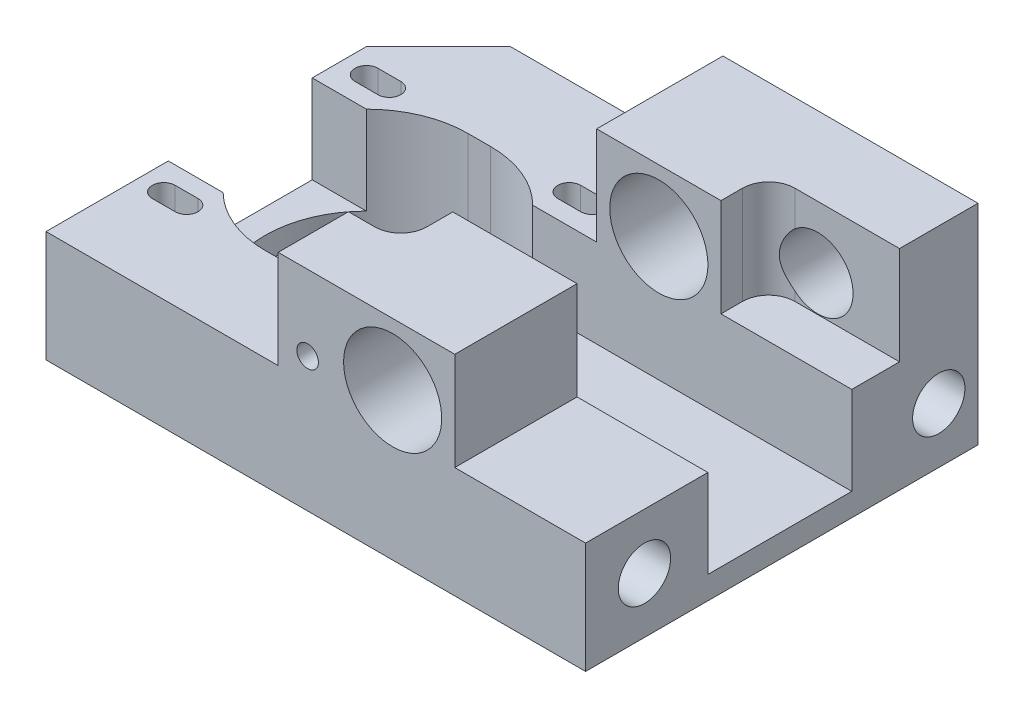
SolidWorks part; units mm, degrees
ref_plane "Plan de face" through (0, 0, 0) normal (0, 0, 1) x (1, 0, 0)
ref_plane "Plan de dessus" through (0, 0, 0) normal (0, 1, 0) x (1, 0, 0)
ref_plane "Plan de droite" through (0, 0, 0) normal (1, 0, 0) x (0, 0, -1)
sketch "Esquisse1" plane through (0, 0, 0) normal (0, 1, 0) x (1, 0, 0)
  line L0 (0, 0) -> (0, 49)
  line L1 (0, 49) -> (11, 60)
  line L2 (11, 60) -> (82.5, 60)
  line L3 (82.5, 60) -> (82.5, 0)
  line L4 (82.5, 0) -> (0, 0)
  line L5 (34.75, 47) -> (38.25, 47)
  line L6 (3.75, 47) -> (7.25, 47)
  line L7 (34.75, 43.5) -> (38.25, 43.5)
  line L8 (3.75, 43.5) -> (7.25, 43.5)
  line L9 (34.75, 16) -> (38.25, 16)
  line L10 (34.75, 12.5) -> (38.25, 12.5)
  line L11 (3.75, 16) -> (7.25, 16)
  line L12 (3.75, 12.5) -> (7.25, 12.5)
  line L13 (19.25, 29.75) -> (22.75, 29.75) construction
  line L14 (19.25, 45.25) -> (22.75, 45.25)
  line L15 (19.25, 14.25) -> (22.75, 14.25)
  arc A0 (7.25, 47) -> (7.25, 43.5) centre (7.25, 45.25) cw
  arc A1 (3.75, 47) -> (3.75, 43.5) centre (3.75, 45.25) ccw
  arc A2 (34.75, 47) -> (34.75, 43.5) centre (34.75, 45.25) ccw
  arc A3 (38.25, 47) -> (38.25, 43.5) centre (38.25, 45.25) cw
  arc A4 (34.75, 16) -> (34.75, 12.5) centre (34.75, 14.25) ccw
  arc A5 (38.25, 16) -> (38.25, 12.5) centre (38.25, 14.25) cw
  arc A6 (3.75, 16) -> (3.75, 12.5) centre (3.75, 14.25) ccw
  arc A7 (7.25, 16) -> (7.25, 12.5) centre (7.25, 14.25) cw
  arc A8 (19.25, 45.25) -> (19.25, 14.25) centre (19.25, 29.75) ccw
  arc A9 (22.75, 14.25) -> (22.75, 45.25) centre (22.75, 29.75) ccw
  point P32 (21, 29.75)
  dimension "D7" = 1.75
  dimension "D11" = 15.5
  dimension "D1" = 82.5
  dimension "D2" = 60
  dimension "D3" = 11
  dimension "D4" = 11
  dimension "D5" = 16.5
  dimension "D6" = 3.75
  dimension "D10" = 3.5
  dimension "D12" = 21
  dimension "D13" = 3.5
  dimension "D14" = 30.25
  dimension "D15" = 31
  dimension "D16" = 31
  dimension "D8" = 2
  dimension "D9" = 2
extrude "Boss.-Extru.1" add sketch "Esquisse1" along normal blind 32
sketch "Esquisse2" plane through (0, 32, 0) normal (0, 1, 0) x (1, 0, 0)
  line L0 (0, 49) -> (11, 60)
  line L1 (11, 60) -> (43.5, 60)
  line L2 (82.5, 60) -> (11, 60) construction
  line L3 (43.5, 60) -> (43.5, 14.75)
  line L4 (39.5, 10.75) -> (35.5, 10.75)
  line L5 (35.5, 10.75) -> (35.5, 0)
  line L6 (0, 0) -> (82.5, 0) construction
  line L7 (35.5, 0) -> (0, 0)
  line L8 (0, 0) -> (0, 49)
  line L9 (66.5, 48) -> (82.5, 48)
  line L10 (82.5, 0) -> (82.5, 60) construction
  line L11 (82.5, 48) -> (82.5, 0)
  line L12 (82.5, 0) -> (62.5, 0)
  line L13 (62.5, 0) -> (62.5, 44)
  arc A0 (43.5, 14.75) -> (39.5, 10.75) centre (39.5, 14.75) cw
  arc A1 (66.5, 48) -> (62.5, 44) centre (66.5, 44) ccw
  dimension "D6" = 4
  dimension "D1" = 10.75
  dimension "D2" = 19
  dimension "D3" = 12
  dimension "D4" = 20
  dimension "D5" = 27
extrude "Enlèv. mat.-Extru.1" cut sketch "Esquisse2" against normal blind 15
sketch "Esquisse3" plane through (0, 0, -60) normal (0, 0, -1) x (-1, 0, 0)
  line L0 (-82.5, 0) -> (-11, 0) construction
  line L1 (-82.5, 32) -> (-82.5, 0) construction
  circle A0 centre (-53, 22.5) radius 7.5
  dimension "D3" = 15
  dimension "D1" = 22.5
  dimension "D2" = 29.5
extrude "Enlèv. mat.-Extru.2" cut sketch "Esquisse3" against normal through all
hole_wizard "Trou taraudé M12x1.251" positions "Esquisse5" profile "Esquisse4" tap size "M12x1.25" standard "ISO"
sketch "Esquisse5" plane through (0, 0, -60) normal (0, 0, -1) x (-1, 0, 0)
  line L0 (-82.5, 0) -> (-11, 0) construction
  line L1 (-82.5, 32) -> (-82.5, 0) construction
  point P0 (-70, 22.5)
  dimension "D1" = 22.5
  dimension "D2" = 12.5
sketch "Esquisse4" plane through (70, 22.5, -60) normal (1, 0, 0) x (0, 1, 0)
  line L0 (0, 0) -> (0, 60)
  line L1 (0, 60) -> (5.4, 60)
  line L2 (5.4, 60) -> (5.4, 0)
  line L5 (5.4, 0) -> (0, 0)
  line L11 (0, -6.35) -> (0, 107.95) construction
  dimension "Diamètre du trou pour taraudage jusqu'au prochain" = 10.8
  dimension "Profondeur du trou pour taraudage jusqu'au prochain" = 60
hole_wizard "Trou taraudé M41" positions "Esquisse7" profile "Esquisse6" tap size "M4" standard "ISO"
sketch "Esquisse7" plane through (0, 0, 0) normal (0, 0, 1) x (1, 0, 0)
  line L0 (82.5, 17) -> (82.5, 0) construction
  line L1 (0, 0) -> (82.5, 0) construction
  point P0 (40, 20.5)
  dimension "D1" = 42.5
  dimension "D2" = 20.5
sketch "Esquisse6" plane through (40, 20.5, 0) normal (1, 0, 0) x (0, -1, 0)
  line L0 (0, 0) -> (0, 60)
  line L1 (0, 60) -> (1.65, 60)
  line L2 (1.65, 60) -> (1.65, 0)
  line L5 (1.65, 0) -> (0, 0)
  line L11 (0, -6.35) -> (0, 107.95) construction
  dimension "Diamètre du trou pour taraudage jusqu'au prochain" = 3.3
  dimension "Profondeur du trou pour taraudage jusqu'au prochain" = 60
hole_wizard "Trous de centrage Ø8.0mm1" positions "Esquisse9" profile "Esquisse8" hole size "Ø8.0" standard "ISO"
sketch "Esquisse9" plane through (82.5, 0, 0) normal (1, 0, 0) x (0, 0, -1)
  line L0 (60, 32) -> (60, 0) construction
  line L1 (0, 0) -> (60, 0) construction
  point P0 (9, 8.5)
  point P2 (54, 8.5)
  dimension "D1" = 45
  dimension "D2" = 6
  dimension "D3" = 8.5
sketch "Esquisse8" plane through (82.5, 8.5, -9) normal (0, 1, 0) x (0, 0, -1)
  line L0 (0, 0) -> (0, 41.4034)
  line L1 (0, 41.4034) -> (4, 39)
  line L2 (4, 39) -> (4, 0)
  line L5 (4, 0) -> (0, 0)
  line L10 (0, 41.4034) -> (-4, 39) construction
  line L11 (0, -6.35) -> (0, 107.95) construction
  dimension "Diamètre du perçage" = 8
  dimension "Profondeur du perçage" = 39
  dimension "Angle de pointe" = 118
sketch "Esquisse10" plane through (82.5, 0, 0) normal (1, 0, 0) x (0, 0, -1)
  line L0 (0, 0) -> (60, 0) construction
  line L1 (18.7, 35.9855) -> (40.7, 35.9855)
  line L2 (18.7, 35.9855) -> (18.7, 3.5)
  line L3 (18.7, 3.5) -> (40.7, 3.5)
  line L4 (40.7, 35.9855) -> (40.7, 3.5)
  line L5 (60, 32) -> (60, 0) construction
  dimension "D1" = 22
  dimension "D2" = 3.5
  dimension "D3" = 19.3
extrude "Enlèv. mat.-Extru.3" cut sketch "Esquisse10" against normal through all
